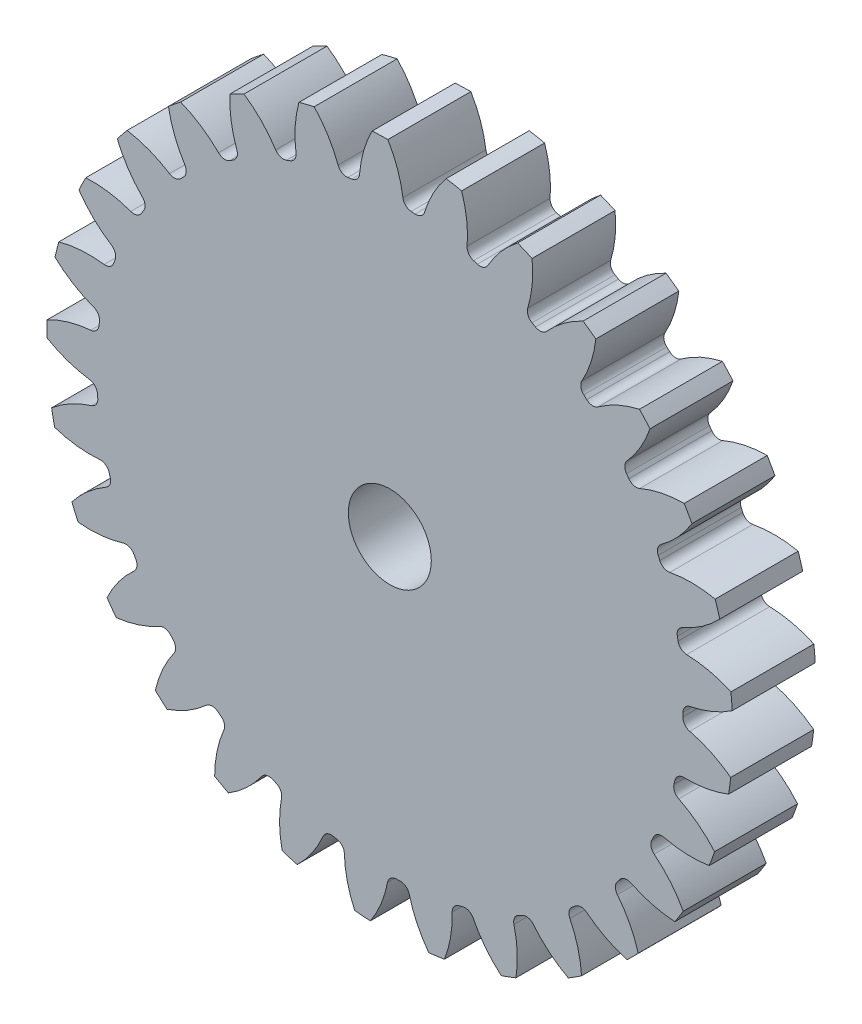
SolidWorks part; units mm, degrees
ref_plane "Front" through (0, 0, 0) normal (0, 0, 1) x (1, 0, 0)
ref_plane "Top" through (0, 0, 0) normal (0, 1, 0) x (1, 0, 0)
ref_plane "Right" through (0, 0, 0) normal (1, 0, 0) x (0, 0, -1)
sketch "Sketch3" plane through (0, 0, 0) normal (0, 0, 1) x (1, 0, 0)
  circle A0 centre (0, 0) radius 524.9333
  dimension "od" = 1049.8667
extrude "gearBody" add sketch "Sketch3" along normal blind 127
sketch "Sketch2" plane through (0, 0, 0) normal (0, 0, 1) x (1, 0, 0)
  line L0 (0, 0) -> (426.3258, 176.5899) construction
  line L1 (522.61, -58.8313) -> (0, 0) construction
  line L2 (0, 0) -> (36.3143, 0) construction
  line L3 (490.8683, 13.9581) -> (489.5139, -39.021) construction
  line L5 (490.1911, -12.5315) -> (0, 0) construction
  line L7 (0, 0) -> (461.4517, 0) construction
  arc A0 (461.4227, 5.1751) -> (460.5556, -28.745) centre (0, 0) ccw construction
  arc A1 (523.9925, 31.414) -> (521.703, -58.1466) centre (0, 0) ccw construction
  arc A2 (490.8683, 13.9581) -> (489.5139, -39.021) centre (0, 0) ccw construction
  arc A3 (448.4985, -14.5153) -> (448.6543, -8.4199) centre (0, 0) ccw
  arc A4 (522.61, -58.8313) -> (458.9503, -28.3379) centre (416.746, -198.1426) ccw
  arc A5 (522.61, -58.8313) -> (524.9333, 32.0514) centre (0, 0) ccw
  arc A6 (524.9333, 32.0514) -> (459.7987, 4.8506) centre (426.3258, 176.5899) cw
  arc A7 (448.6543, -8.4199) -> (459.7987, 4.8506) centre (462.4356, -8.6786) cw
  arc A8 (458.9503, -28.3379) -> (448.4985, -14.5153) centre (462.275, -14.9612) cw
  point P6 (524.9333, 32.0514)
  point P22 (522.61, -58.8313)
  dimension "baseDia" = 922.9034
  dimension "od" = 1049.8667
  dimension "pd" = 982.1333
  dimension "rd" = 897.4667
  dimension "rFillet" = 13.7837
  dimension "pointX" = 524.9333
  dimension "pointY" = 32.0514
  dimension "CTT" = 52.9791
  dimension "flankCenterAngle" = 22.5
extrude "toothCut" cut sketch "Sketch2" along normal through all
pattern_circular "CirPattern1" count 29 over 360 about axis through (0, 0, 0) along (0, 0, 1) of "toothCut"
sketch "hub1Dia" plane through (0, 0, 0) normal (0, 0, -1) x (-1, 0, 0)
  circle A0 centre (0, 0) radius 12.7
  dimension "hub1Dia" = 25.4
sketch "hub2Dia" plane through (0, 0, 127) normal (0, 0, 1) x (1, 0, 0)
  circle A0 centre (0, 0) radius 12.7
  dimension "hub2dia" = 25.4
sketch "boreDia" plane through (0, 0, 0) normal (0, 0, 1) x (1, 0, 0)
  circle A0 centre (0, 0) radius 63.5
  dimension "boreDia" = 127
extrude "bore" cut sketch "boreDia" against normal mid plane 25400
